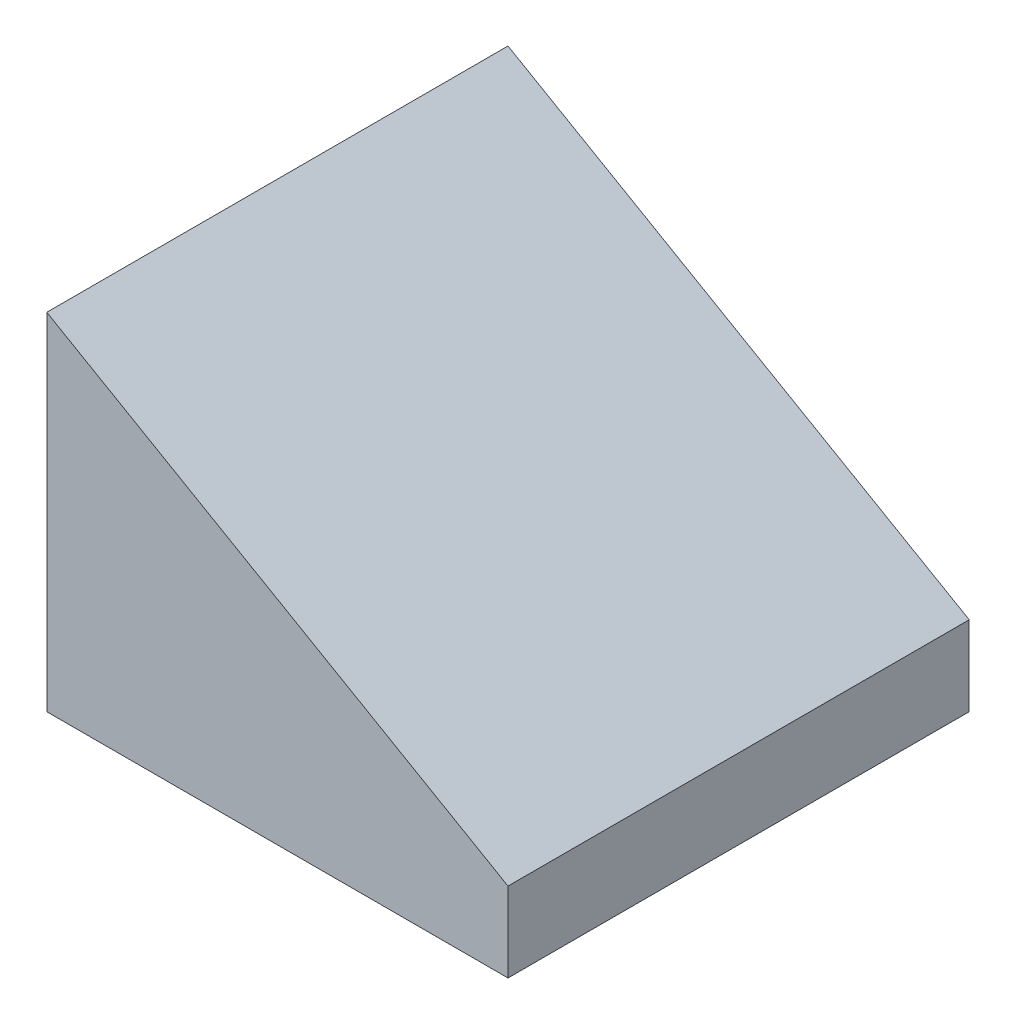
SolidWorks part; units mm, degrees
ref_plane "Vorne" through (0, 0, 0) normal (0, 0, 1) x (1, 0, 0)
ref_plane "Oben" through (0, 0, 0) normal (0, 1, 0) x (1, 0, 0)
ref_plane "Rechts" through (0, 0, 0) normal (1, 0, 0) x (0, 0, -1)
sketch "Skizze2" plane through (0, 0, 0) normal (0, 0, 1) x (1, 0, 0)
  line L0 (0, 0) -> (0, 6.4)
  line L1 (0, 6.4) -> (8, 1.7812)
  line L2 (8, 1.7812) -> (8, 0)
  line L3 (8, 0) -> (0, 0)
  dimension "D1" = 6.4
  dimension "D2" = 8
  dimension "D3" = 120
extrude "Linear austragen1" add sketch "Skizze2" along normal blind 8
sketch "Skizze3" plane through (0, 0, 0) normal (0, -1, 0) x (1, 0, 0)
  line L0 (0, 8) -> (8, 8) construction
  line L1 (0.4, 7.6) -> (7.6, 7.6)
  line L2 (0.4, 7.6) -> (0.4, 0.4)
  line L3 (0.4, 0.4) -> (7.6, 0.4)
  line L4 (7.6, 7.6) -> (7.6, 0.4)
  line L5 (0, 8) -> (0, 0) construction
  line L6 (8, 8) -> (8, 0) construction
  line L7 (0, 0) -> (8, 0) construction
  dimension "D1" = 0.4
  dimension "D2" = 0.4
  dimension "D3" = 0.4
  dimension "D4" = 0.4
extrude "Schnitt-Linear austragen1" cut sketch "Skizze3" against normal blind 0.4 contours L1 L4 L3 L2 M4 M1 M2 M3
sketch "Skizze4" plane through (0, 0, 0) normal (0, 0, -1) x (-1, 0, 0)
  line L0 (-6.5, 0) -> (-6.5, 1.6)
  line L1 (-0.4, 0) -> (-7.6, 0) construction
  line L2 (-6.5, 1.6) -> (-1.5, 4.4868)
  line L3 (-1.5, 4.4868) -> (-1.5, 0)
  line L4 (-1.5, 0) -> (-6.5, 0)
  line L5 (0, 6.4) -> (0, 0.4) construction
  line L6 (-8, 0.4) -> (-8, 1.7812) construction
  line L7 (-8, 1.7812) -> (0, 6.4) construction
  dimension "D1" = 1.5
  dimension "D2" = 1.5
  dimension "D3" = 1.6
extrude "Schnitt-Linear austragen2" cut sketch "Skizze4" against normal blind 5 from offset 1.5
sketch "Skizze5" plane through (0, 0, 0) normal (0, -1, 0) x (1, 0, 0)
  line L0 (0, 8) -> (0, 0) construction
  line L1 (0, 8) -> (8, 8) construction
  circle A0 centre (4, 4) radius 2.45
  dimension "D1" = 4.9
  dimension "D2" = 4
  dimension "D3" = 4
extrude "Schnitt-Linear austragen3" cut sketch "Skizze5" against normal blind 2.2
